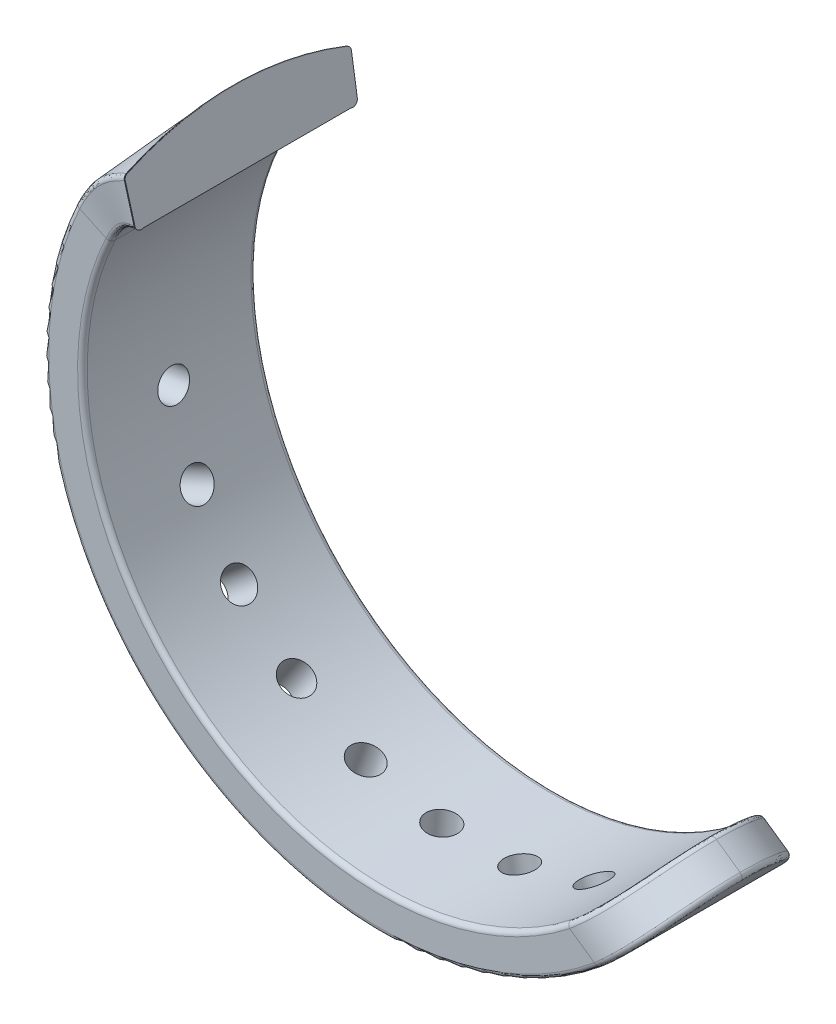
SolidWorks part; units mm, degrees
ref_plane "Front" through (0, 0, 0) normal (0, 0, 1) x (1, 0, 0)
ref_plane "Top" through (0, 0, 0) normal (0, 1, 0) x (1, 0, 0)
ref_plane "Right" through (0, 0, 0) normal (1, 0, 0) x (0, 0, -1)
sketch "Sketch1" plane through (0, 0, 0) normal (0, 0, 1) x (1, 0, 0)
  line L0 (0, -12.9439) -> (0, 22.7544) construction
  line L1 (0, 11.4045) -> (0, -18.309) construction
  line L2 (41.5205, 0) -> (-42.8426, 0) construction
  line L3 (-25.3937, -3.2191) -> (40.1686, -49.1264) construction
  line L4 (0, -21) -> (45.4516, -21) construction
  line L5 (0, -21) -> (-37.4484, -3.5375) construction
  arc A1 (-31.7208, -6.2084) -> (28.6703, -41.0752) centre (0, -21) ccw
  point P12 (27.032, -39.928)
  dimension "D1" = 35
  dimension "D2" = 21
  dimension "D3" = 35
  dimension "D4" = 25
extrude "Base-Extrude-Thin" add sketch "Sketch1" along normal mid plane 18 thin
fillet "Fillet1" radius 9 4 edges at (27.032, -39.928, -9) (25.3937, -38.7809, 0) (28.6703, -41.0752, 0) (27.032, -39.928, 9)
fillet "Fillet12" radius 0.5 8 edges at (-19.272, -45.2815, 9) (27.4951, -42.6569, 5.6192) (26.5449, -43.8115, -7.0933) (23.2344, -41.5223, 7.1116) (24.213, -40.358, -5.6184) (-21.2826, -48.7858, 9) (-19.272, -45.2815, -9) (-21.2826, -48.7858, -9)
sketch "Sketch8" plane through (-8.0435, -17.2493, 0) normal (0.4226, 0.9063, 0) x (-0.9063, 0.4226, 0)
  line L4 (25.625, 9) -> (22.625, 9)
  line L5 (22.125, 8.5) -> (22.125, -8.5)
  line L6 (22.625, -9) -> (25.625, -9)
  line L7 (26.125, -8.5) -> (26.125, 8.5)
  line L8 (25.625, 9) -> (22.625, 9)
  line L9 (22.125, 8.5) -> (22.125, -8.5)
  line L10 (22.625, -9) -> (25.625, -9)
  line L11 (26.125, -8.5) -> (26.125, 8.5)
  arc A4 (22.625, 9) -> (22.125, 8.5) centre (22.625, 8.5) ccw
  arc A5 (22.125, -8.5) -> (22.625, -9) centre (22.625, -8.5) ccw
  arc A6 (25.625, -9) -> (26.125, -8.5) centre (25.625, -8.5) ccw
  arc A7 (26.125, 8.5) -> (25.625, 9) centre (25.625, 8.5) ccw
  arc A8 (22.625, 9) -> (22.125, 8.5) centre (22.625, 8.5) ccw
  arc A9 (22.125, -8.5) -> (22.625, -9) centre (22.625, -8.5) ccw
  arc A10 (25.625, -9) -> (26.125, -8.5) centre (25.625, -8.5) ccw
  arc A11 (26.125, 8.5) -> (25.625, 9) centre (25.625, 8.5) ccw
  dimension "D1" = 0
sketch "Sketch9" plane through (-22.5389, -4.7908, 0) normal (-0.9781, -0.2079, 0) x (0, 0, 1)
  line L0 (10.7597, 1.763) -> (-10.7597, 1.763)
  line L2 (-11.733, 6.1266) -> (-11.538, 2.2275)
  line L3 (11.538, 2.2275) -> (11.733, 6.1266)
  line L4 (-11.733, 6.1266) -> (-11.538, 2.2275)
  line L5 (11.538, 2.2275) -> (11.733, 6.1266)
  arc A2 (11.4194, 6.5883) -> (-11.4194, 6.5883) centre (0, -25.1028) ccw
  arc A3 (10.7597, 1.763) -> (-10.7597, 1.763) centre (0, -26.2411) ccw
  arc A4 (11.4194, 6.5883) -> (-11.4194, 6.5883) centre (0, -25.1028) ccw
  spline S4 degree 3 poles (-11.4194, 6.5883) (-11.514, 6.5542) (-11.597, 6.4926) (-11.7101, 6.3281) (-11.738, 6.2272) (-11.733, 6.1266) knots 0 0 0 0 0.5 0.5 1 1 1 1
  spline S5 degree 3 poles (-11.538, 2.2275) (-11.5292, 2.0511) (-11.4176, 1.8919) (-11.1131, 1.7177) (-10.9242, 1.6998) (-10.7597, 1.763) knots 0 0 0 0 0.5 0.5 1 1 1 1
  spline S6 degree 3 poles (10.7597, 1.763) (10.9244, 1.6997) (11.1142, 1.7183) (11.3408, 1.8479) (11.4069, 1.9079) (11.5041, 2.0547) (11.5336, 2.1391) (11.538, 2.2275) knots 0 0 0 0 0.5 0.5 0.75 0.75 1 1 1 1
  spline S7 degree 3 poles (11.733, 6.1266) (11.738, 6.2271) (11.7107, 6.3269) (11.5973, 6.4924) (11.514, 6.5542) (11.4194, 6.5883) knots 0 0 0 0 0.5 0.5 1 1 1 1
  spline S8 degree 3 poles (-11.4194, 6.5883) (-11.514, 6.5542) (-11.597, 6.4926) (-11.7101, 6.3281) (-11.738, 6.2272) (-11.733, 6.1266) knots 0 0 0 0 0.5 0.5 1 1 1 1
  spline S9 degree 3 poles (-11.538, 2.2275) (-11.5292, 2.0511) (-11.4176, 1.8919) (-11.1131, 1.7177) (-10.9242, 1.6998) (-10.7597, 1.763) knots 0 0 0 0 0.5 0.5 1 1 1 1
  spline S10 degree 3 poles (10.7597, 1.763) (10.9244, 1.6997) (11.1142, 1.7183) (11.3408, 1.8479) (11.4069, 1.9079) (11.5041, 2.0547) (11.5336, 2.1391) (11.538, 2.2275) knots 0 0 0 0 0.5 0.5 0.75 0.75 1 1 1 1
  spline S11 degree 3 poles (11.733, 6.1266) (11.738, 6.2271) (11.7107, 6.3269) (11.5973, 6.4924) (11.514, 6.5542) (11.4194, 6.5883) knots 0 0 0 0 0.5 0.5 1 1 1 1
  dimension "D1" = 0
surface "Surface-Offset1" parameters "D1"=0.1
loft "Boss-Loft8" add profiles "Sketch8", "Sketch9"
sketch "Sketch10" plane through (0, 0, 0) normal (0, 0, 1) x (1, 0, 0)
  line L0 (0, -21) -> (-50, -21) construction
  line L1 (0, -21) -> (-4.3578, -70.8097) construction
  line L2 (0, -21) -> (-38.3022, -53.1394) construction
  line L4 (0, -21) -> (-17.101, -67.9846) construction
  line L5 (0, -21) -> (-49.2404, -29.6824) construction
  line L6 (0, -21) -> (-45.3154, -42.1309) construction
  line L7 (0, -21) -> (8.6824, -70.2404) construction
  line L8 (0, -21) -> (21.1309, -66.3154) construction
  line L9 (0, -21) -> (-28.6788, -61.9576) construction
  circle A0 centre (0, -21) radius 40 construction
  dimension "D1" = 40
  dimension "D9" = 80
  dimension "D2" = 115
  dimension "D3" = 100
  dimension "D4" = 85
  dimension "D5" = 70
  dimension "D6" = 55
  dimension "D7" = 25
  dimension "D8" = 10
ref_plane "Plane1" through (-49.2404, -29.6824, 0) normal (-0.9848, -0.1736, 0) x (0, 0, 1)
sketch "Sketch12" plane through (-49.2404, -29.6824, 0) normal (-0.9848, -0.1736, 0) x (0, 0, 1)
  circle A0 centre (0, 0) radius 1.625
  dimension "D1" = 3.25
extrude "Cut-Extrude2" cut sketch "Sketch12" against normal blind 50
ref_plane "Plane2" through (0, -21, 0) normal (-1, 0, 0) x (0, 0, 1)
sketch "Sketch13" plane through (0, -21, 0) normal (-1, 0, 0) x (0, 0, 1)
  line L0 (0, 0) -> (-50, 0)
pattern_circular "CirPattern1" count 8 every 15 about axis through (0, -21, 9) along (0, 0, -1) of "Cut-Extrude2"
